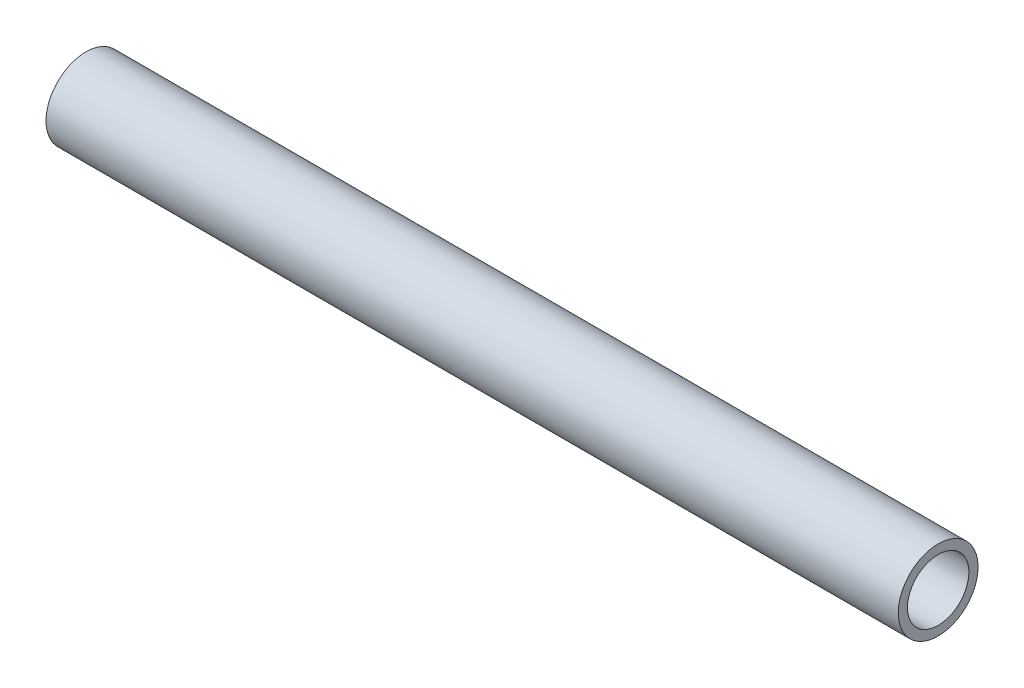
SolidWorks part; units mm, degrees
ref_plane "Front" through (0, 0, 0) normal (0, 0, 1) x (1, 0, 0)
ref_plane "Top" through (0, 0, 0) normal (0, 1, 0) x (1, 0, 0)
ref_plane "Right" through (0, 0, 0) normal (1, 0, 0) x (0, 0, -1)
sketch "Sketch1" plane through (0, 0, 0) normal (0, 0, 1) x (1, 0, 0)
  line L0 (0, 0) -> (352.425, 0)
  line L1 (9.9848, 0) -> (-9.9848, 0) construction
  dimension "D1" = 352.425
other "Structural Member1"
ref_plane "Plane1" through (0, 0, 0) normal (1, 0, 0) x (0, 0, -1)
sketch "Sketch11" plane through (0, 0, 0) normal (1, 0, 0) x (0, 0, -1)
  circle A0 centre (0, 0) radius 12.7
  circle A1 centre (0, 0) radius 16.51
  point P3 (0, 0)
  dimension "D1" = 33.02
  dimension "D2" = 25.4
